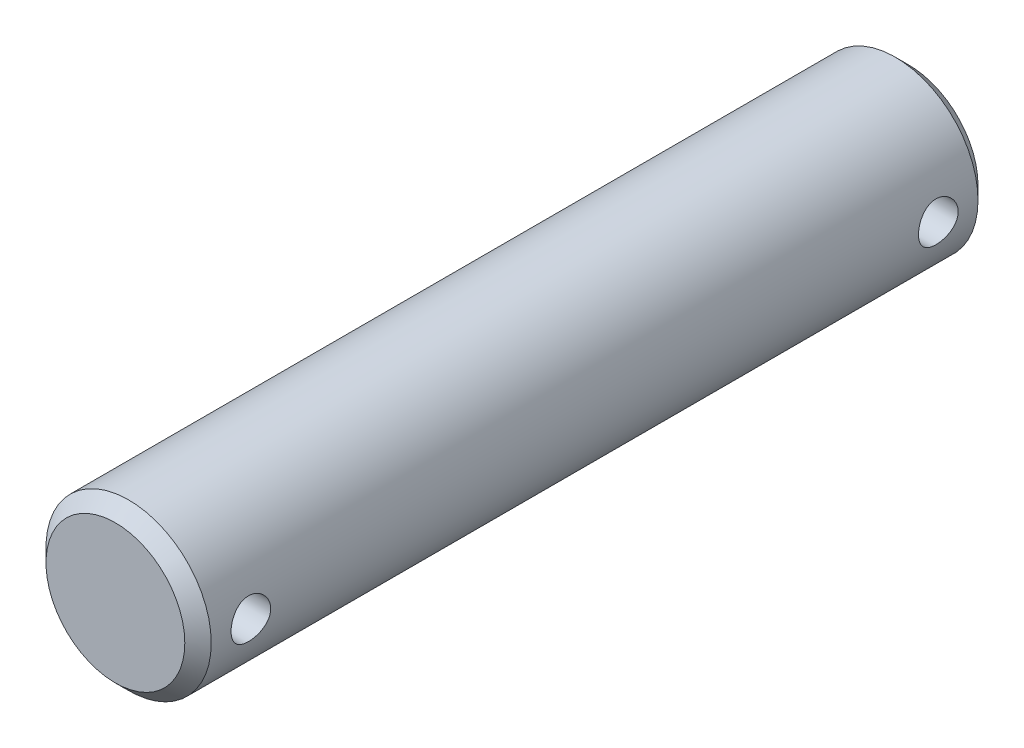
SolidWorks part; units mm, degrees
ref_plane "Face" through (0, 0, 0) normal (0, 0, 1) x (1, 0, 0)
ref_plane "Dessus" through (0, 0, 0) normal (0, 1, 0) x (1, 0, 0)
ref_plane "Droite" through (0, 0, 0) normal (1, 0, 0) x (0, 0, -1)
sketch "Esquisse1" plane through (0, 0, 0) normal (0, 0, 1) x (1, 0, 0)
  circle A0 centre (0, 0) radius 12.5
  dimension "D1" = 25
extrude "Base-Extrusion" add sketch "Esquisse1" along normal blind 120
chamfer "Chanfrein1" distance 2 angle 45
sketch "Esquisse2" plane through (0, 0, 0) normal (1, 0, 0) x (0, 0, -1)
  line L0 (-118, 0) -> (-2, 0) construction
  line L1 (0, -10.5) -> (0, 10.5) construction
  line L2 (-120, 10.5) -> (-120, -10.5) construction
  circle A0 centre (-8, 0) radius 3
  circle A1 centre (-112, 0) radius 3
  dimension "D1" = 6
  dimension "D2" = 8
  dimension "D3" = 8
extrude "Enlèv. mat.-Extru.1" cut sketch "Esquisse2" against normal mid plane 28
